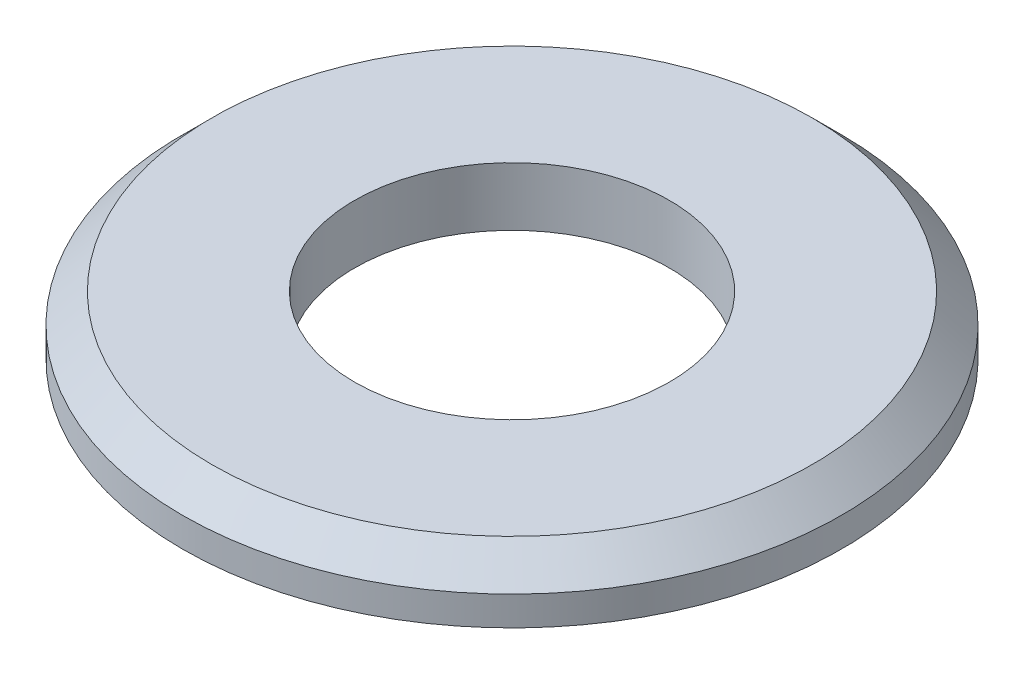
SolidWorks part; units mm, degrees
ref_plane "Front" through (0, 0, 0) normal (0, 0, 1) x (1, 0, 0)
ref_plane "Top" through (0, 0, 0) normal (0, 1, 0) x (1, 0, 0)
ref_plane "Right" through (0, 0, 0) normal (1, 0, 0) x (0, 0, -1)
sketch "Sketch1" plane through (0, 0, 0) normal (0, 1, 0) x (1, 0, 0)
  circle A0 centre (0, 0) radius 2.15
  circle A1 centre (0, 0) radius 4.5
extrude "Extrude1" add sketch "Sketch1" along normal blind 0.8
chamfer "Chamfer1" distance 0.4 1 edges at (0, 0.8, 4.5)
